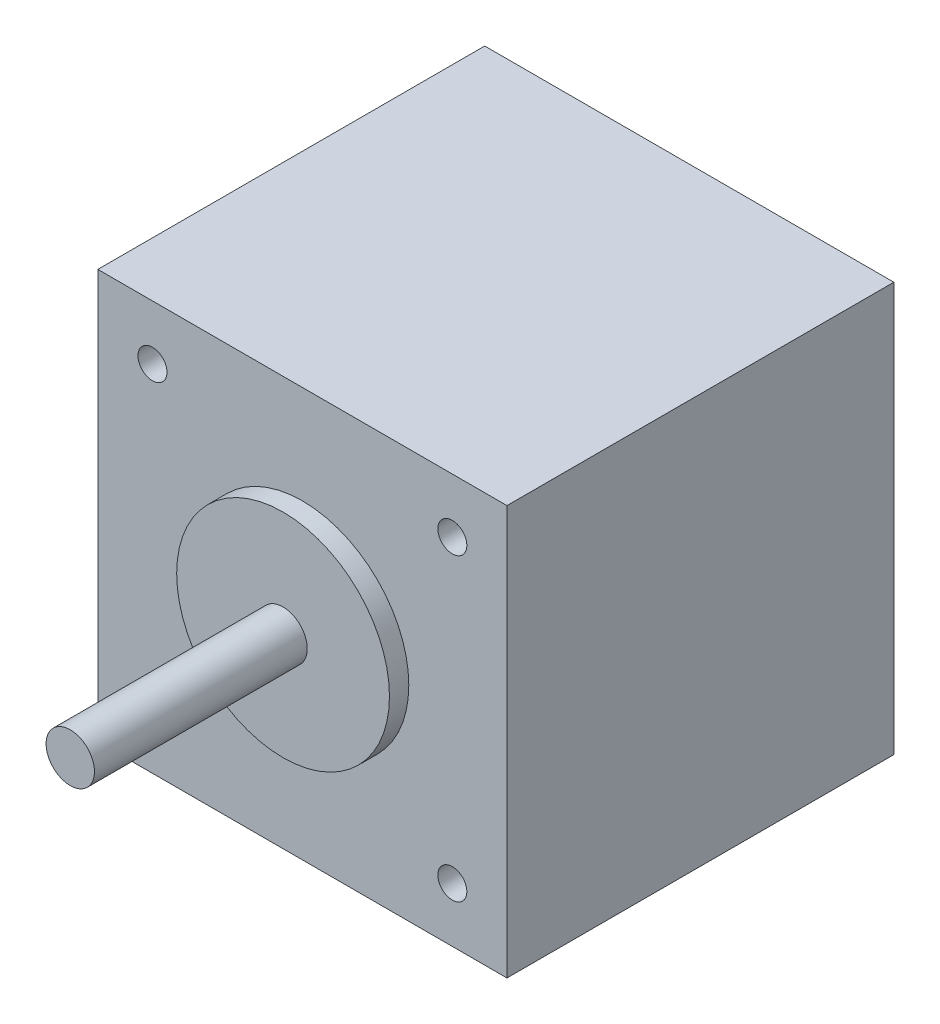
SolidWorks part; units mm, degrees
ref_plane "Ebene vorne" through (0, 0, 0) normal (0, 0, 1) x (1, 0, 0)
ref_plane "Ebene oben" through (0, 0, 0) normal (0, 1, 0) x (1, 0, 0)
ref_plane "Ebene rechts" through (0, 0, 0) normal (1, 0, 0) x (0, 0, -1)
sketch "Skizze1" plane through (0, 0, 0) normal (0, 0, 1) x (1, 0, 0)
  line L1 (0, 0) -> (42.3, 0)
  line L2 (0, 0) -> (0, 42.3)
  line L3 (0, 42.3) -> (42.3, 42.3)
  line L4 (42.3, 0) -> (42.3, 42.3)
  dimension "D1" = 42.3
  dimension "D2" = 42.3
extrude "Aufsatz-Linear austragen1" add sketch "Skizze1" along normal blind 40
sketch "Skizze2" plane through (0, 0, 40) normal (0, 0, 1) x (1, 0, 0)
  line L0 (0, 42.3) -> (0, 0) construction
  line L4 (42.3, 42.3) -> (0, 42.3) construction
  circle A0 centre (21.15, 21.15) radius 11
  dimension "D1" = 22
  dimension "D2" = 21.15
  dimension "D3" = 21.15
extrude "Aufsatz-Linear austragen2" add sketch "Skizze2" along normal blind 2 contours A0
sketch "Skizze5" plane through (0, 0, 42) normal (0, 0, 1) x (1, 0, 0)
  line L0 (0, 42.3) -> (0, 0) construction
  line L3 (42.3, 42.3) -> (0, 42.3) construction
  circle A0 centre (21.15, 21.15) radius 2.5
  dimension "D3" = 5
  dimension "D1" = 21.15
  dimension "D2" = 21.15
extrude "Aufsatz-Linear austragen3" add sketch "Skizze5" along normal blind 22 contours A0
sketch "Skizze6" plane through (0, 0, 40) normal (0, 0, 1) x (1, 0, 0)
  line L0 (0, 42.3) -> (0, 0) construction
  line L2 (42.3, 42.3) -> (0, 42.3) construction
  circle A0 centre (5.65, 36.65) radius 1.5
  circle A1 centre (36.65, 36.65) radius 1.5
  circle A2 centre (36.65, 5.65) radius 1.5
  circle A3 centre (5.65, 5.65) radius 1.5
  dimension "D1" = 3
  dimension "D2" = 3
  dimension "D3" = 3
  dimension "D4" = 3
  dimension "D5" = 31
  dimension "D6" = 31
  dimension "D7" = 31
  dimension "D8" = 5.65
  dimension "D9" = 5.65
  dimension "D10" = 31
extrude "Schnitt-Linear austragen1" cut sketch "Skizze6" against normal blind 4.5
